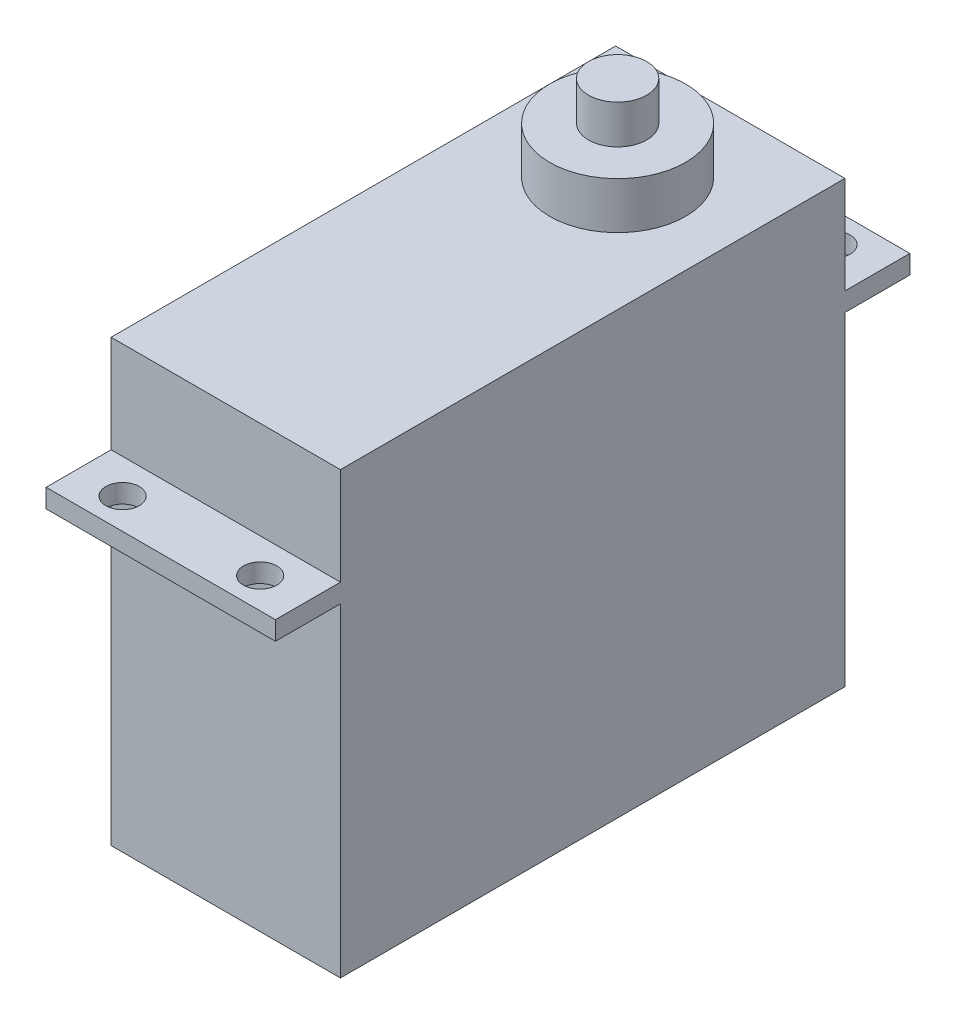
SolidWorks part; units mm, degrees
ref_plane "Front Plane" through (0, 0, 0) normal (0, 0, 1) x (1, 0, 0)
ref_plane "Top Plane" through (0, 0, 0) normal (0, 1, 0) x (1, 0, 0)
ref_plane "Right Plane" through (0, 0, 0) normal (1, 0, 0) x (0, 0, -1)
sketch "Sketch1" plane through (0, 0, 0) normal (0, 1, 0) x (1, 0, 0)
  line L0 (-15, 0) -> (15, 0) construction
  line L1 (-15, 33) -> (15, 33)
  line L2 (-15, 33) -> (-15, -33)
  line L3 (-15, -33) -> (15, -33)
  line L4 (15, 33) -> (15, -33)
  point P4 (-15, 0)
  point P5 (15, 0)
  dimension "D1" = 30
  dimension "D2" = 66
extrude "Extrude1" add sketch "Sketch1" along normal blind 57.6
sketch "Sketch3" plane through (0, 0, 33) normal (0, 0, 1) x (1, 0, 0)
  line L1 (-15, 44.85) -> (15, 44.85)
  line L2 (-15, 44.85) -> (-15, 42.4)
  line L3 (-15, 42.4) -> (15, 42.4)
  line L4 (15, 44.85) -> (15, 42.4)
  line L5 (15, 57.6) -> (15, 0) construction
  line L6 (-15, 57.6) -> (-15, 0) construction
  line L7 (-15, 0) -> (15, 0) construction
  dimension "D1" = 2.45
  dimension "D2" = 42.4
extrude "Extrude3" add sketch "Sketch3" along normal blind 8.5
mirror "Mirror1" about plane through (0, 0, 0) normal (0, 0, 1) of "Extrude3"
sketch "Sketch4" plane through (0, 57.6, 0) normal (0, 1, 0) x (1, 0, 0)
  line L0 (15, 33) -> (-15, 33) construction
  line L1 (0, 0) -> (0, 33) construction
  line L2 (15, 33) -> (-15, 33) construction
  circle A0 centre (0, 18.268) radius 8.89
  dimension "D1" = 17.78
  dimension "D2" = 14.732
sketch "Sketch5" plane through (0, 44.85, 0) normal (0, 1, 0) x (1, 0, 0)
  line L0 (0, -33) -> (0, -41.5) construction
  line L1 (15, -33) -> (-15, -33) construction
  line L2 (15, -41.5) -> (-15, -41.5) construction
  circle A0 centre (9, -37.5) radius 2.1844
  point P6 (9, -37.5)
  dimension "D3" = 4.3688
  dimension "D1" = 4.5
  dimension "D2" = 9
extrude "Cut-Extrude1" cut sketch "Sketch5" against normal through all
mirror "Mirror2" about plane through (0, 0, 0) normal (0, 0, 1) of "Cut-Extrude1"
mirror "Mirror3" about plane through (0, 0, 0) normal (1, 0, 0) of "Mirror2", "Cut-Extrude1"
extrude "Extrude4" add sketch "Sketch4" along normal blind 6.12
sketch "Sketch6" plane through (0, 63.72, 0) normal (0, 1, 0) x (1, 0, 0)
  circle A0 centre (0, 18.268) radius 3.81
  point P0 (0, 18.268)
  dimension "D1" = 7.62
extrude "Extrude5" add sketch "Sketch6" along normal blind 5.08
